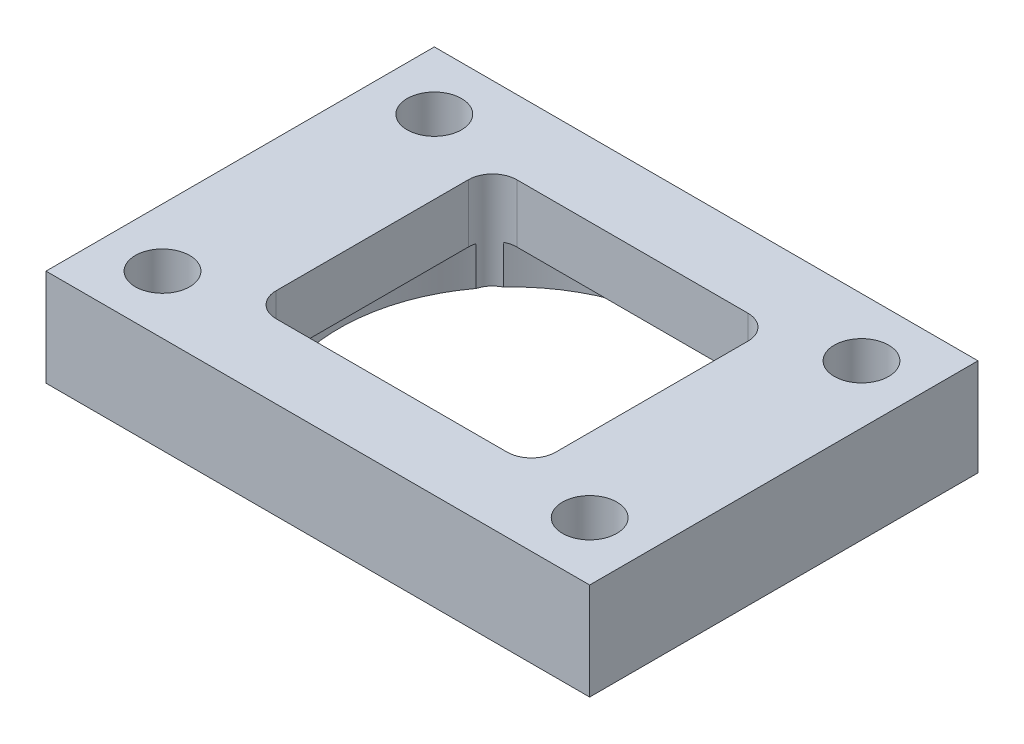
SolidWorks part; units mm, degrees
ref_plane "Front Plane" through (0, 0, 0) normal (0, 0, 1) x (1, 0, 0)
ref_plane "Top Plane" through (0, 0, 0) normal (0, 1, 0) x (1, 0, 0)
ref_plane "Right Plane" through (0, 0, 0) normal (1, 0, 0) x (0, 0, -1)
sketch "Sketch1" plane through (0, 0, 0) normal (0, 1, 0) x (1, 0, 0)
  line L0 (0, 0) -> (0, 12.7) construction
  line L1 (0, 0) -> (17.78, 0) construction
  line L2 (17.78, -12.7) -> (17.78, 12.7)
  line L3 (17.78, 12.7) -> (-17.78, 12.7)
  line L4 (17.78, -12.7) -> (-17.78, -12.7)
  line L5 (-17.78, -12.7) -> (-17.78, 12.7)
  point P9 (0, -12.7)
  dimension "D1" = 12.7
  dimension "D2" = 17.78
extrude "plate" add sketch "Sketch1" along normal blind 6.35
sketch "Sketch2" plane through (0, 6.35, 0) normal (0, 1, 0) x (1, 0, 0)
  line L0 (0, 0) -> (17.78, 0) construction
  line L1 (17.78, -12.7) -> (17.78, 12.7) construction
  line L2 (0, 0) -> (0, 12.7) construction
  line L3 (17.78, 12.7) -> (-17.78, 12.7) construction
  circle A0 centre (13.97, 8.89) radius 1.778
  circle A1 centre (13.97, -8.89) radius 1.778
  circle A2 centre (-13.97, -8.89) radius 1.778
  circle A3 centre (-13.97, 8.89) radius 1.778
  dimension "D1" = 3.556
  dimension "D2" = 13.97
  dimension "D3" = 8.89
extrude "mount_holes" cut sketch "Sketch2" against normal through all
sketch "Sketch3" plane through (0, 0, 0) normal (0, -1, 0) x (1, 0, 0)
  circle A0 centre (0, 0) radius 11.303
  dimension "D1" = 22.606
extrude "seat_cbore" cut sketch "Sketch3" against normal blind 2.54
sketch "Sketch4" plane through (0, 6.35, 0) normal (0, 1, 0) x (1, 0, 0)
  line L0 (0, 0) -> (9.144, 0) construction
  line L1 (0, 0) -> (0, 7.874) construction
  line L2 (9.144, -7.874) -> (9.144, 7.874)
  line L3 (9.144, 7.874) -> (-9.144, 7.874)
  line L4 (9.144, -7.874) -> (-9.144, -7.874)
  line L5 (-9.144, -7.874) -> (-9.144, 7.874)
  point P9 (0, -7.874)
  dimension "D1" = 7.874
  dimension "D2" = 9.144
extrude "square_thru" cut sketch "Sketch4" against normal through all
fillet "Fillet1" radius 1.5875 4 edges at (9.144, 3.175, -7.874) (9.144, 3.175, 7.874) (-9.144, 3.175, 7.874) (-9.144, 3.175, -7.874)
